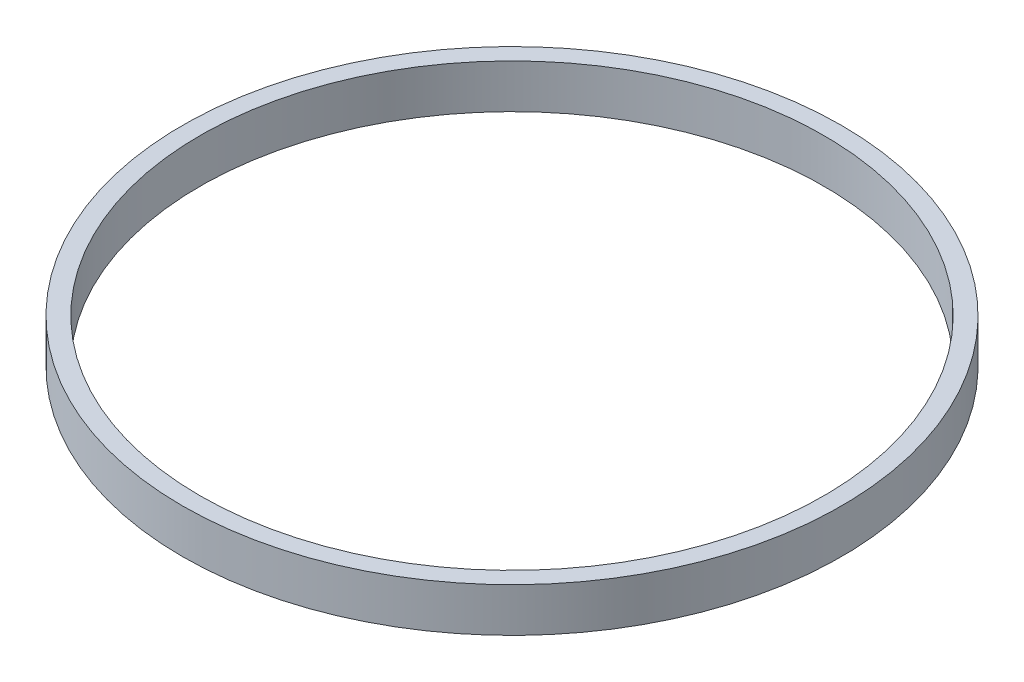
SolidWorks part; units mm, degrees
ref_plane "Front Plane" through (0, 0, 0) normal (0, 0, 1) x (1, 0, 0)
ref_plane "Top Plane" through (0, 0, 0) normal (0, 1, 0) x (1, 0, 0)
ref_plane "Right Plane" through (0, 0, 0) normal (1, 0, 0) x (0, 0, -1)
sketch "Sketch1" plane through (0, 0, 0) normal (0, 1, 0) x (1, 0, 0)
  circle A0 centre (0, 0) radius 75
  circle A1 centre (0, 0) radius 71
  dimension "D1" = 150
  dimension "D2" = 4
extrude "Boss-Extrude1" add sketch "Sketch1" along normal blind 10
